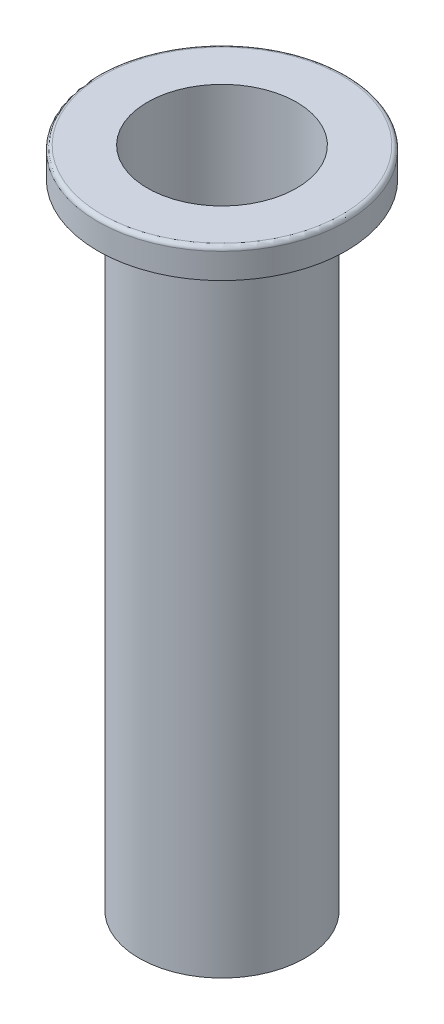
SolidWorks part; units mm, degrees
ref_plane "Alzado" through (0, 0, 0) normal (0, 0, 1) x (1, 0, 0)
ref_plane "Planta" through (0, 0, 0) normal (0, 1, 0) x (1, 0, 0)
ref_plane "Vista lateral" through (0, 0, 0) normal (1, 0, 0) x (0, 0, -1)
sketch "Croquis1" plane through (0, 0, 0) normal (0, 1, 0) x (1, 0, 0)
  circle A0 centre (0, 0) radius 20
  dimension "D1" = 40
extrude "Saliente-Extruir1" add sketch "Croquis1" against normal blind 150
sketch "Croquis2" plane through (0, 0, 0) normal (0, 1, 0) x (1, 0, 0)
  circle A0 centre (0, 0) radius 30
  dimension "D1" = 60
extrude "Saliente-Extruir2" add sketch "Croquis2" along normal blind 10
sketch "Croquis3" plane through (0, -150, 0) normal (0, -1, 0) x (1, 0, 0)
  circle A2 centre (0, 0) radius 18
  circle A3 centre (0, 0) radius 18
  dimension "D1" = 2
extrude "Cortar-Extruir1" cut sketch "Croquis3" against normal through all
chamfer "Chaflán1" distance 5 angle 30 1 edges at (0, 0, 30)
fillet "Redondeo1" radius 1 1 edges at (0, 10, 30)
